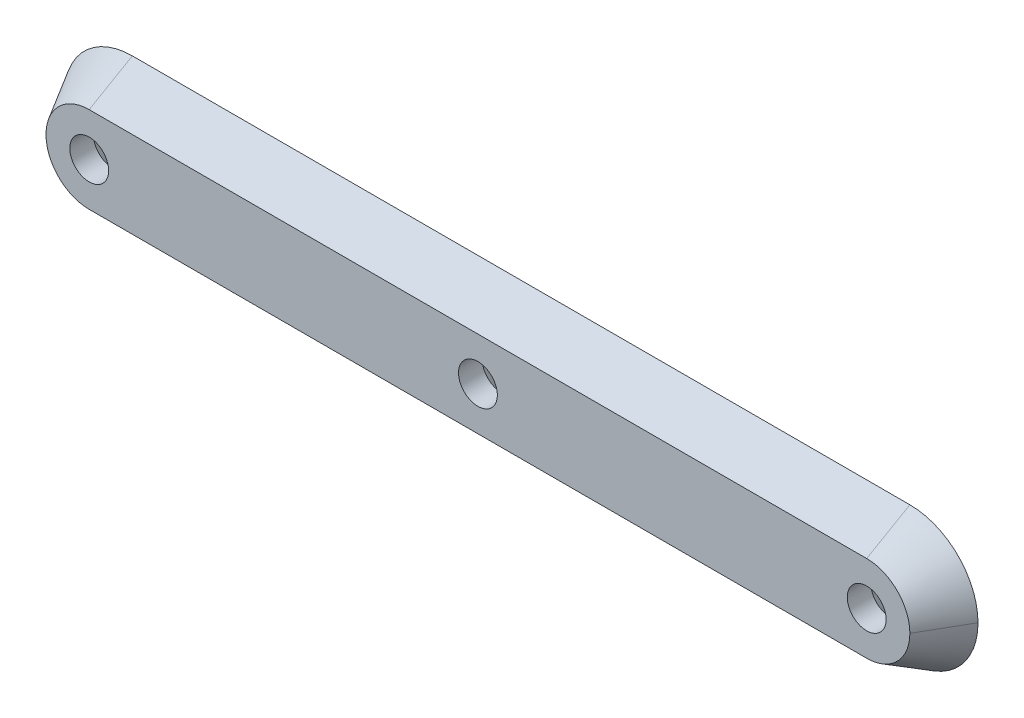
SolidWorks part; units mm, degrees
ref_plane "Front" through (0, 0, 0) normal (0, 0, 1) x (1, 0, 0)
ref_plane "Top" through (0, 0, 0) normal (0, 1, 0) x (1, 0, 0)
ref_plane "Right" through (0, 0, 0) normal (1, 0, 0) x (0, 0, -1)
sketch "Sketch1" plane through (0, 0, 0) normal (0, 0, 1) x (1, 0, 0)
  line L1 (50, -5) -> (-50, -5)
  line L2 (50, -5) -> (50, 5)
  line L3 (50, 5) -> (-50, 5)
  line L4 (-50, -5) -> (-50, 5)
  line L5 (50, -5) -> (-50, 5) construction
  line L6 (50, 5) -> (-50, -5) construction
  point P0 (0, 0)
  dimension "D1" = 10
  dimension "D2" = 100
extrude "Extrude1" add sketch "Sketch1" along normal blind 5
fillet "Fillet1" radius 5 4 edges at (-50, -5, 2.5) (-50, 5, 2.5) (50, 5, 2.5) (50, -5, 2.5)
draft "Draft1" type of draft neutral plane draft angle 30 faces to draft 6 parameters "D1"=30
hole_wizard "CSK for #8 Flat Head Machine Screw1" positions "Sketch3" profile "Sketch2" countersink size "#8" standard "ANSI Inch"
sketch "Sketch3" plane through (0, 0, 0) normal (0, 0, -1) x (-1, 0, 0)
  point P0 (0, 0)
sketch "Sketch2" plane through (0, 0, 0) normal (1, 0, 0) x (0, 1, 0)
  line L0 (0, 0) -> (0, 5)
  line L1 (0, 5) -> (2.2479, 5)
  line L2 (2.2479, 5) -> (2.2479, 2.2645)
  line L3 (2.2479, 2.2645) -> (4.2164, 0)
  line L5 (4.2164, 0) -> (0, 0)
  line L6 (-2.2479, 2.2645) -> (-4.2164, 0) construction
  line L11 (0, -6.35) -> (0, 107.95) construction
  dimension "Thru Hole Dia." = 4.4958
  dimension "Thru Hole Depth" = 5
  dimension "Near C'Sink Dia." = 8.4328
  dimension "Near C'Sink Angle" = 82
pattern_linear "LPattern1" count 2 spacing 45 along (-1, 0, 0) count 2 spacing 45 along (1, 0, 0) of "CSK for #8 Flat Head Machine Screw1"
